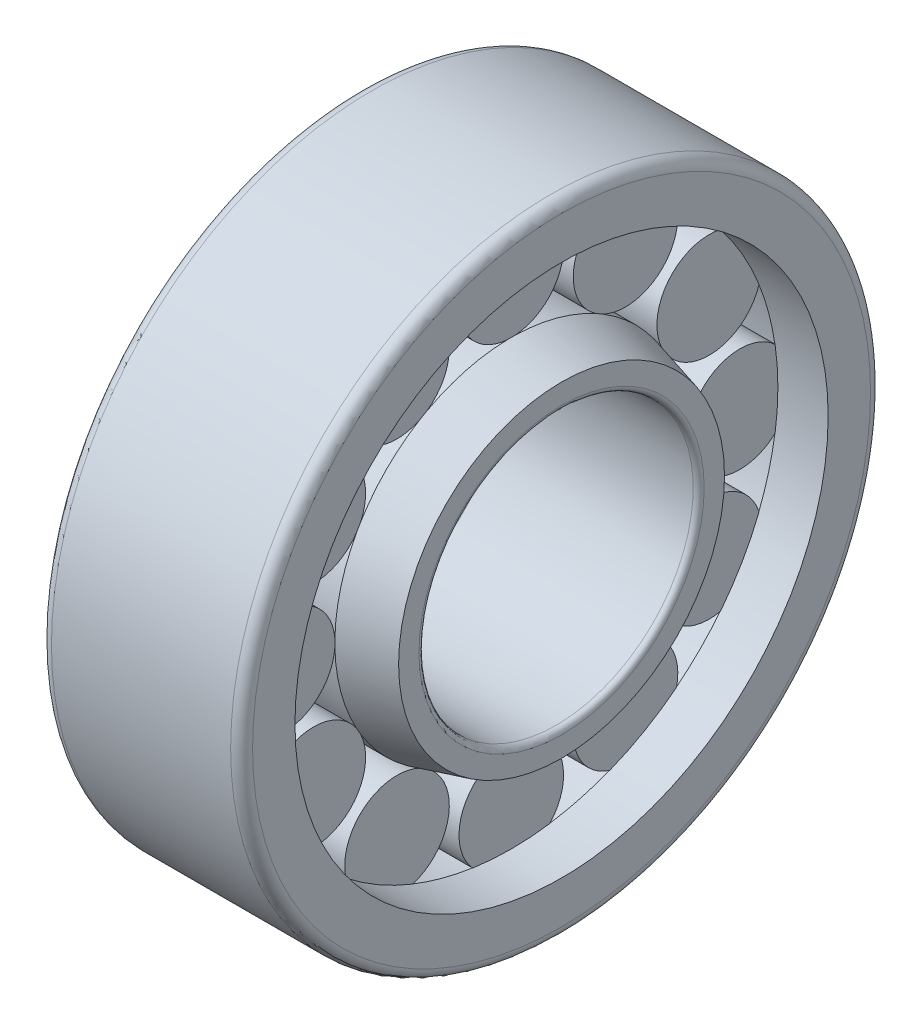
SolidWorks part; units mm, degrees
ref_plane "Front" through (0, 0, 0) normal (0, 0, 1) x (1, 0, 0)
ref_plane "Top" through (0, 0, 0) normal (0, 1, 0) x (1, 0, 0)
ref_plane "Right" through (0, 0, 0) normal (1, 0, 0) x (0, 0, -1)
sketch "Sketch1" plane through (0, 0, 0) normal (0, 0, 1) x (1, 0, 0)
  line L0 (-5.5, 7.5) -> (5.5, 7.5)
  line L1 (5.5, 7.5) -> (5.5, 8.9131)
  line L2 (5.5, 8.9131) -> (2.75, 9.65)
  line L3 (2.75, 9.65) -> (-2.75, 9.65)
  line L4 (-2.75, 9.65) -> (-5.5, 8.9131)
  line L5 (-5.5, 8.9131) -> (-5.5, 7.5)
  line L6 (-10.1379, 0) -> (10.5422, 0) construction
  dimension "B" = 11
  dimension "D2" = 5.5
  dimension "d" = 15
  dimension "FW" = 19.3
  dimension "D5" = 15
  dimension "D6" = 15
  dimension "D7" = 5.5
  dimension "D8" = 2.75
revolve "Revolve1" add sketch "Sketch1" angle 360 about L6
sketch "Sketch2" plane through (0, 0, 0) normal (0, 0, 1) x (1, 0, 0)
  line L0 (-2.75, 9.64) -> (2.75, 9.64)
  line L1 (2.75, 9.64) -> (2.75, 12.5)
  line L2 (-2.75, 12.5) -> (2.75, 12.5)
  line L3 (-2.75, 12.5) -> (-2.75, 9.64)
  line L4 (-7.1198, 0) -> (7.769, 0) construction
  line L6 (-7.4228, 12.5) -> (7.769, 12.5) construction
  dimension "D1" = 19.28
  dimension "D2" = 12.5
  dimension "D4" = 5.5
  dimension "D5" = 2.75
revolve "Revolve2" add sketch "Sketch2" angle 360 about L6
sketch "Sketch3" plane through (0, 0, 0) normal (0, 0, 1) x (1, 0, 0)
  line L0 (-5.5, 17.5) -> (5.5, 17.5)
  line L1 (5.5, 17.5) -> (5.5, 14.5825)
  line L2 (5.5, 14.5825) -> (2.74, 14.5825)
  line L3 (2.74, 14.5825) -> (2.74, 15.35)
  line L4 (2.74, 15.35) -> (-2.74, 15.35)
  line L5 (-2.74, 15.35) -> (-2.74, 14.5825)
  line L6 (-2.74, 14.5825) -> (-5.5, 14.5825)
  line L7 (-5.5, 14.5825) -> (-5.5, 17.5)
  line L8 (-9.0822, 0) -> (10.5352, 0) construction
  dimension "DD" = 35
  dimension "D2" = 30.7
  dimension "D3" = 29.165
  dimension "B" = 11
  dimension "D5" = 5.5
  dimension "D6" = 5.48
  dimension "D7" = 2.74
revolve "Revolve3" add sketch "Sketch3" angle 360 about L8
pattern_circular "Circular-Pattern1" count 12 over 360 about axis through (0, 0, 0) along (1, 0, 0) of "Revolve2"
fillet "Fillet1" radius 0.6 2 edges at (-5.5, 0, 17.5) (5.5, 0, 17.5)
fillet "Fillet2" radius 0.3 2 edges at (5.5, 0, 7.5) (-5.5, 0, 7.5)
equation "\"D2@Sketch1\" = \"B@Sketch1\" / 2"
equation "\"D7@Sketch1\" = \"D2@Sketch1\""
equation "\"D8@Sketch1\" = \"D7@Sketch1\"/2"
equation "\"D2@Sketch2\" = ( \"DD@Sketch3\" + \"d@Sketch1\" )  / 4"
equation "\"D4@Sketch2\" = \"B@Sketch1\" / 2"
equation "\"D5@Sketch2\" = \"D4@Sketch2\" / 2"
equation "\"D1@Sketch2\" = \"FW@Sketch1\" - 0.02"
equation "\"B@Sketch3\" = \"B@Sketch1\""
equation "\"D5@Sketch3\" = \"B@Sketch3\" / 2"
equation "\"D6@Sketch3\" = \"D5@Sketch3\" - 0.02"
equation "\"D7@Sketch3\" = \"D6@Sketch3\" / 2"
equation "\"D2@Sketch3\" = ( \"DD@Sketch3\" + \"d@Sketch1\" )  / 4 * 2 + ( ( \"DD@Sketch3\" + \"d@Sketch1\" )  / 4 * 2 - \"FW@Sketch1\"  ) "
equation "\"D3@Sketch3\" = \"D2@Sketch3\" * 0.95"
equation "\"m@Circular-Pattern1\"=int(3.14159265/atn(((\"DD@Sketch3\"+\"d@Sketch1\")/4-\"FW@Sketch1\"/2+0.02) / sqr((\"DD@Sketch3\"+\"d@Sketch1\")/4  * (\"DD@Sketch3\"+\"d@Sketch1\")/4 - ((\"DD@Sketch3\"+\"d@Sketch1\")/4-\"FW@Sketc"
